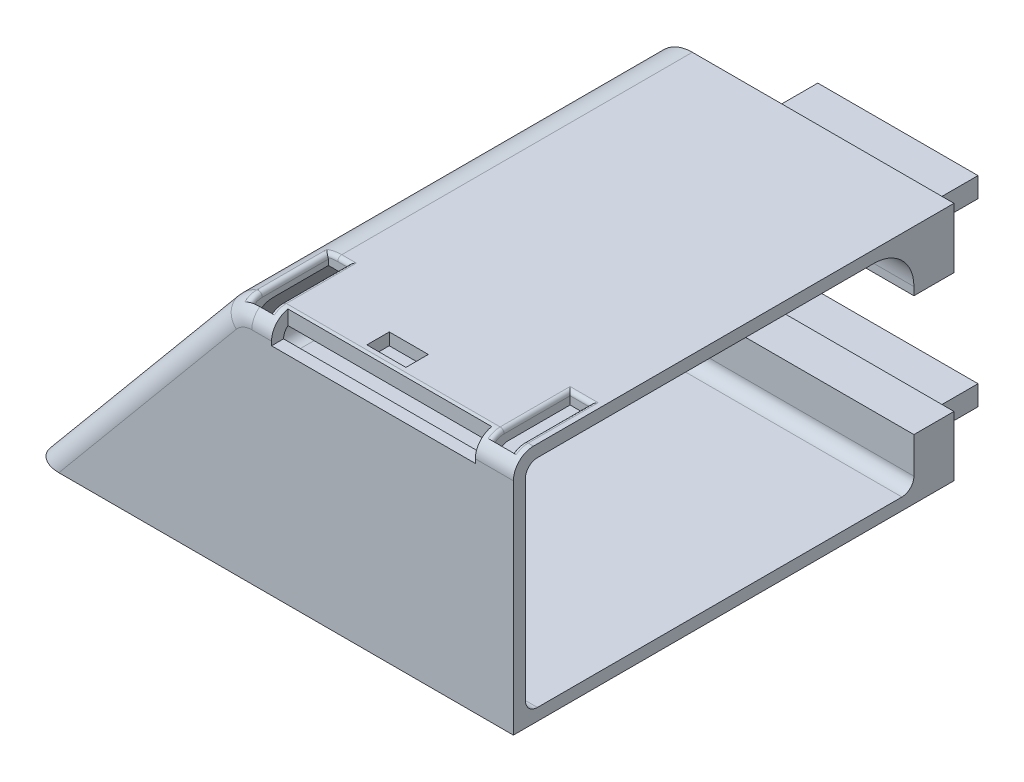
SolidWorks part; units mm, degrees
ref_plane "Front Plane" through (0, 0, 0) normal (0, 0, 1) x (1, 0, 0)
ref_plane "Top Plane" through (0, 0, 0) normal (0, 1, 0) x (1, 0, 0)
ref_plane "Right Plane" through (0, 0, 0) normal (1, 0, 0) x (0, 0, -1)
sketch "Sketch1" plane through (0, 0, 0) normal (0, 0, 1) x (1, 0, 0)
  line L0 (-70, 60) -> (0, 60)
  line L1 (0, 60) -> (0, 0)
  line L2 (0, 0) -> (-120, 0)
  line L3 (-120, 0) -> (-70, 60)
  dimension "D1" = 120
  dimension "D2" = 60
  dimension "D3" = 70
  dimension "D4" = 78.1025
extrude "Boss-Extrude1" add sketch "Sketch1" against normal blind 110
shell "Shell1" thickness 3
sketch "Sketch2" plane through (0, 0, -110) normal (0, 0, -1) x (-1, 0, 0)
  line L0 (0.25, 50) -> (60.25, 50)
  line L1 (60.25, 50) -> (100.25, 10)
  line L2 (100.25, 10) -> (0.25, 10)
  line L3 (0.25, 10) -> (0.25, 50)
  line L4 (120, 0) -> (0, 0) construction
  line L5 (0, 60) -> (70, 60) construction
  line L6 (0, 0) -> (0, 60) construction
  dimension "D1" = 100
  dimension "D2" = 40
  dimension "D3" = 10
  dimension "D4" = 10
  dimension "D5" = 45
  dimension "D6" = 56.5685
  dimension "D7" = 40
  dimension "D8" = 0.25
extrude "Cut-Extrude1" cut sketch "Sketch2" against normal blind 71
sketch "Sketch3" plane through (0, 0, 0) normal (1, 0, 0) x (0, 0, -1)
  line L0 (110, 0) -> (110, 60) construction
  line L1 (110, 50) -> (107, 50)
  line L2 (110, 50) -> (110, 10)
  line L3 (110, 10) -> (107, 10)
  line L4 (107, 50) -> (107, 10)
  line L5 (107, 3) -> (107, 57) construction
  line L6 (110, 60) -> (0, 60) construction
  dimension "D1" = 10
  dimension "D2" = 40
extrude "Cut-Extrude2" cut sketch "Sketch3" against normal blind 8
sketch "Sketch4" plane through (0, 0, -110) normal (0, 0, -1) x (-1, 0, 0)
  line L0 (0, 60) -> (70, 60) construction
  line L1 (120, 0) -> (0, 0) construction
  line L2 (0, 0) -> (0, 10) construction
  line L3 (0, 50) -> (0, 60) construction
  line L4 (60.25, 50) -> (0, 50) construction
  line L5 (0, 10) -> (100.25, 10) construction
  circle A0 centre (23, 55) radius 2.925
  circle A1 centre (48, 55) radius 2.925
  circle A2 centre (23, 5) radius 2.925
  circle A3 centre (48, 5) radius 2.925
  dimension "D1" = 5.85
  dimension "D2" = 5.85
  dimension "D3" = 5.85
  dimension "D4" = 5.85
  dimension "D13" = 5.85
  dimension "D5" = 25
  dimension "D6" = 25
  dimension "D7" = 5
  dimension "D8" = 5
  dimension "D9" = 23
  dimension "D10" = 23
  dimension "D11" = 5
  dimension "D12" = 5
sketch "Sketch6" plane through (0, 60, 0) normal (0, 1, 0) x (1, 0, 0)
  line L0 (-70, 110) -> (-70, 0) construction
  line L1 (-60.38, 4.1) -> (-9.51, 4.1)
  line L2 (-60.38, 4.1) -> (-60.38, 0)
  line L3 (-60.38, 0) -> (-9.51, 0)
  line L4 (-9.51, 4.1) -> (-9.51, 0)
  line L7 (0, 0) -> (-70, 0) construction
  dimension "D1" = 50.87
  dimension "D2" = 4.1
  dimension "D3" = 9.62
  dimension "D4" = 0
  dimension "D5" = 0
extrude "Cut-Extrude3" cut sketch "Sketch6" against normal blind 6
sketch "Sketch7" plane through (0, 60, 0) normal (0, 1, 0) x (1, 0, 0)
  line L0 (0, 0) -> (-9.51, 0) construction
  line L1 (-7.31, 2) -> (-2.31, 2)
  line L2 (-7.31, 2) -> (-7.31, 21.47)
  line L3 (-7.31, 21.47) -> (-2.31, 21.47)
  line L4 (-2.31, 2) -> (-2.31, 21.47)
  line L5 (0, 110) -> (0, 0) construction
  dimension "D1" = 5
  dimension "D2" = 2
  dimension "D3" = 2.31
  dimension "D4" = 19.47
extrude "Cut-Extrude4" cut sketch "Sketch7" against normal blind 6
sketch "Sketch8" plane through (0, 60, 0) normal (0, 1, 0) x (1, 0, 0)
  line L0 (-60.38, 0) -> (-70, 0) construction
  line L1 (-67.69, 2) -> (-62.69, 2)
  line L2 (-67.69, 2) -> (-67.69, 21.47)
  line L3 (-67.69, 21.47) -> (-62.69, 21.47)
  line L4 (-62.69, 2) -> (-62.69, 21.47)
  line L5 (-70, 110) -> (-70, 0) construction
  dimension "D1" = 5
  dimension "D2" = 19.47
  dimension "D3" = 2
  dimension "D4" = 2.31
extrude "Cut-Extrude5" cut sketch "Sketch8" against normal blind 6
sketch "Sketch9" plane through (0, 60, 0) normal (0, 1, 0) x (1, 0, 0)
  line L0 (-62.69, 2) -> (-62.69, 21.47) construction
  line L1 (-42.69, 11.7) -> (-32.94, 11.7)
  line L2 (-42.69, 11.7) -> (-42.69, 6.1)
  line L3 (-42.69, 6.1) -> (-32.94, 6.1)
  line L4 (-32.94, 11.7) -> (-32.94, 6.1)
  line L5 (-9.51, 4.1) -> (-60.38, 4.1) construction
  dimension "D1" = 9.75
  dimension "D2" = 5.6
  dimension "D3" = 20
  dimension "D4" = 2
extrude "Cut-Extrude6" cut sketch "Sketch9" against normal blind 8
sketch "Sketch10" plane through (-70.8197, 59.0164, 0) normal (-0.7682, 0.6402, 0) x (0, 0, 1)
  line L0 (-110, 1.2804) -> (0, 1.2804) construction
  circle A0 centre (-56.2624, -35.7196) radius 3.6
  dimension "D1" = 7.2
  dimension "D2" = 37
extrude "Cut-Extrude8" cut sketch "Sketch10" against normal blind 10
sketch "Sketch11" plane through (0, 0, -110) normal (0, 0, -1) x (-1, 0, 0)
  line L0 (0, 60) -> (70, 60)
  line L1 (0, 60) -> (70, 60) construction
  line L2 (70, 60) -> (120, 0)
  line L3 (120, 0) -> (0, 0)
  line L4 (0, 0) -> (0, 10)
  line L5 (0, 10) -> (100.25, 10)
  line L6 (100.25, 10) -> (60.25, 50)
  line L7 (60.25, 50) -> (0, 50)
  line L8 (0, 50) -> (0, 60)
extrude "Boss-Extrude2" add sketch "Sketch11" against normal blind 10
sketch "Sketch12" plane through (0, 0, -110) normal (0, 0, -1) x (-1, 0, 0)
  line L0 (0, 60) -> (0, 44.6493)
  line L1 (0, 10) -> (100.25, 10)
  line L2 (100.25, 10) -> (95.25, 15)
  line L3 (100.25, 10) -> (60.25, 50) construction
  line L4 (95.25, 15) -> (0, 15)
  line L5 (0, 15) -> (0, 10)
  dimension "D1" = 5
extrude "Boss-Extrude3" add sketch "Sketch12" against normal blind 10 contours L4 L5 M11 M18
sketch "Sketch13" plane through (0, 0, -110) normal (0, 0, -1) x (-1, 0, 0)
  line L0 (0, 50) -> (0, 45)
  line L1 (0, 45) -> (65.25, 45)
  line L2 (95.25, 15) -> (60.25, 50) construction
  line L3 (65.25, 45) -> (60.25, 50)
  line L4 (60.25, 50) -> (0, 50) construction
  line L5 (60.25, 50) -> (0, 50)
extrude "Boss-Extrude4" add sketch "Sketch13" against normal blind 10
sketch "Sketch14" plane through (0, 0, -110) normal (0, 0, -1) x (-1, 0, 0)
  line L0 (0, 60) -> (70, 60) construction
  line L1 (8, 55) -> (48, 55)
  line L2 (8, 55) -> (8, 50)
  line L3 (8, 50) -> (48, 50)
  line L4 (48, 55) -> (48, 50)
  line L5 (0, 45) -> (0, 60) construction
  dimension "D1" = 40
  dimension "D2" = 5
  dimension "D3" = 5
  dimension "D4" = 8
extrude "Boss-Extrude5" add sketch "Sketch14" along normal blind 14
sketch "Sketch15" plane through (0, 0, -110) normal (0, 0, -1) x (-1, 0, 0)
  line L0 (95.25, 15) -> (0, 15) construction
  line L1 (8, 10) -> (48, 10)
  line L2 (8, 10) -> (8, 5)
  line L3 (8, 5) -> (48, 5)
  line L4 (48, 10) -> (48, 5)
  line L5 (0, 0) -> (0, 15) construction
  dimension "D1" = 40
  dimension "D2" = 5
  dimension "D3" = 5
  dimension "D4" = 8
extrude "Boss-Extrude6" add sketch "Sketch15" along normal blind 14
fillet "Fillet5" radius 10 1 edges at (-70, 60, -55)
fillet "Fillet12" radius 5 3 edges at (-62.8481, 60, 0) (-96.4992, 28.2009, 0) (-69.5578, 59.0559, 0)
sketch "Sketch23" plane through (0, 0, -110) normal (0, 0, -1) x (-1, 0, 0)
  line L0 (120, 0) -> (0, 0) construction
  line L1 (48, 5) -> (48, 10) construction
  line L2 (0, 60) -> (65.3163, 60) construction
  line L3 (48, 50) -> (48, 55) construction
  circle A0 centre (57, 53) radius 1.55
  circle A1 centre (57, 7) radius 1.55
  point P13 (48, 52.5)
  dimension "D1" = 3.1
  dimension "D2" = 3.1
  dimension "D3" = 7
  dimension "D4" = 9
  dimension "D5" = 7
  dimension "D6" = 9
extrude "Cut-Extrude9" cut sketch "Sketch23" against normal blind 24
sketch "Sketch24" plane through (-70.8197, 59.0164, 0) normal (-0.7682, 0.6402, 0) x (0, 0, 1)
  circle A0 centre (-51.2624, -27.7196) radius 1.315
  circle A1 centre (-65.2624, -27.7196) radius 1.315
  circle A2 centre (-56.2624, -35.7196) radius 3.6
  dimension "D1" = 8
  dimension "D4" = 2.63
  dimension "D5" = 2.63
  dimension "D2" = 5
  dimension "D3" = 14
extrude "Cut-Extrude10" cut sketch "Sketch24" against normal blind 4
sketch "Sketch25" plane through (-70.8197, 59.0164, 0) normal (-0.7682, 0.6402, 0) x (0, 0, 1)
  text T0 "<b>Project by:</b>  <b>            Ali Bux & Shahid</b>" font "Century Gothic" height 5.4
fillet "Fillet13" radius 10 1 edges at (-34.2974, 57, -100)
extrude "Cut-Extrude11" cut sketch "Sketch25" against normal blind 1.5
sketch "Sketch26" plane through (-70.8197, 59.0164, 0) normal (-0.7682, 0.6402, 0) x (0, 0, 1)
  circle A0 centre (-65.2624, -27.7196) radius 3
  circle A1 centre (-51.2624, -27.7196) radius 3
  dimension "D1" = 6
  dimension "D2" = 6
extrude "Cut-Extrude12" cut sketch "Sketch26" against normal blind 1.5
fillet "Fillet14" radius 5 1 edges at (-91.0949, 30, -3)
fillet "Fillet15" radius 3 4 edges at (-68.3646, 57, -6.6817) (-68.5949, 57, -49) (-71.0357, 54.0711, -97.0711) (-95.2615, 25, -100)
fillet "Fillet16" radius 3 5 edges at (-54.8449, 3, -100) (-112.4511, 3, -99.1213) (-53.5432, 3, -3) (-111.6886, 3, -4.4645) (-113.5949, 3, -52.5)
fillet "Fillet17" radius 3 1 edges at (-1.155, 57, -3)
fillet "Fillet18" radius 3 1 edges at (-8.41, 57, -3)
fillet "Fillet19" radius 1 3 edges at (-95.9915, 28.8102, -56.2624) (-90.4859, 35.4169, -51.2624) (-90.4859, 35.4169, -65.2624)
fillet "Fillet21" radius 1 6 edges at (-67.69, 59.4383, -3.3856) (-62.69, 59.7434, -3.4189) (-67.69, 59.7142, -13.235) (-66.5117, 59.9283, -21.47) (-64.0031, 60, -21.47) (-62.69, 60, -13.235)
fillet "Fillet22" radius 1 5 edges at (-7.31, 59.7434, -3.4189) (-2.31, 59.7434, -3.4189) (-7.31, 60, -13.235) (-2.31, 60, -13.235) (-4.81, 60, -21.47)
